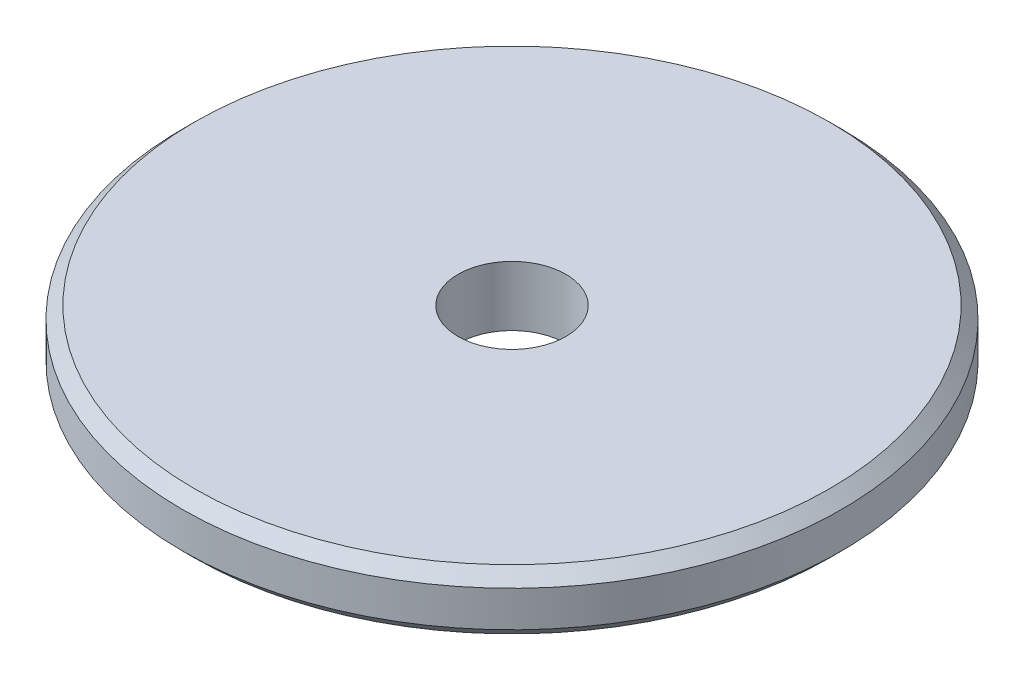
SolidWorks part; units mm, degrees
ref_plane "Front Plane" through (0, 0, 0) normal (0, 0, 1) x (1, 0, 0)
ref_plane "Top Plane" through (0, 0, 0) normal (0, 1, 0) x (1, 0, 0)
ref_plane "Right Plane" through (0, 0, 0) normal (1, 0, 0) x (0, 0, -1)
sketch "Sketch1" plane through (0, 0, 0) normal (0, 1, 0) x (1, 0, 0)
  circle A0 centre (0, 0) radius 27.5
  circle A1 centre (0, 0) radius 4.5
  dimension "D1" = 9
  dimension "D2" = 55
extrude "Extrude1" add sketch "Sketch1" along normal blind 5
chamfer "Chamfer1" distance 1 angle 45 2 edges at (0, 0, 27.5) (0, 5, 27.5)
